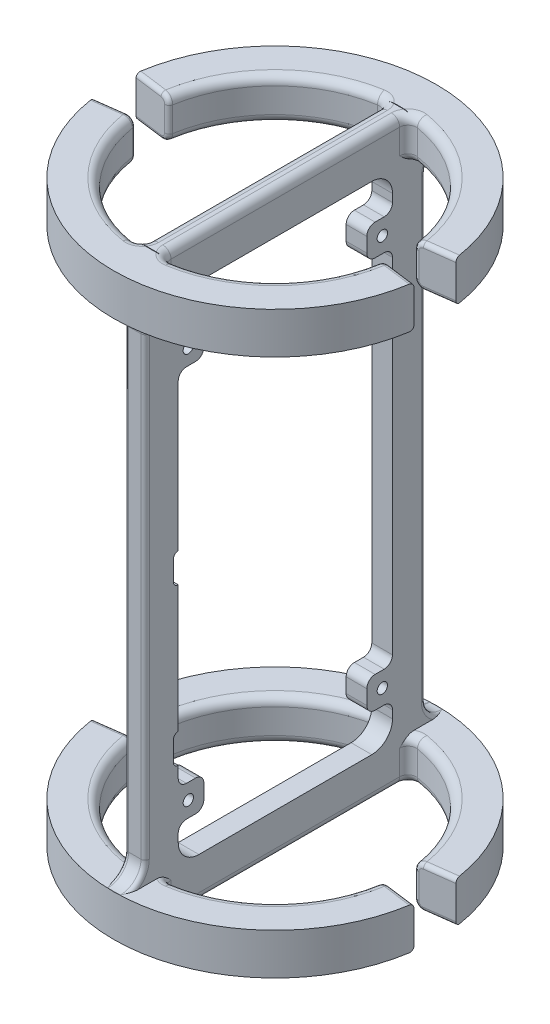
SolidWorks part; units mm, degrees
ref_plane "Front Plane" through (0, 0, 0) normal (0, 0, 1) x (1, 0, 0)
ref_plane "Top Plane" through (0, 0, 0) normal (0, 1, 0) x (1, 0, 0)
ref_plane "Right Plane" through (0, 0, 0) normal (1, 0, 0) x (0, 0, -1)
sketch "Sketch1" plane through (0, 0, 0) normal (0, 1, 0) x (1, 0, 0)
  line L0 (-3.175, -37.9675) -> (-3.175, 37.9675)
  line L3 (3.175, -37.9675) -> (3.175, 37.9675)
  line L4 (-3.164, -37.9684) -> (3.175, 38.1) construction
  line L5 (-3.164, 37.9684) -> (3.164, -37.9684) construction
  circle A0 centre (0, 0) radius 49.53
  circle A1 centre (0, 0) radius 38.1
  dimension "D1" = 99.06
  dimension "D2" = 76.2
  dimension "D3" = 6.35
extrude "Boss-Extrude1" add sketch "Sketch1" along normal blind 12.7 contours A0 A1 | L3 A1 L0
sketch "Sketch4" plane through (0, 12.7, 0) normal (0, 1, 0) x (1, 0, 0)
  line L4 (-3.175, -43.05) -> (-3.175, 43.05)
  line L5 (-3.175, -43.05) -> (3.175, -43.05)
  line L6 (-3.175, 43.05) -> (3.175, 43.05)
  line L7 (3.175, -43.05) -> (3.175, 43.05)
  line L8 (-3.175, -43.05) -> (3.175, 43.05) construction
  line L9 (-3.175, 43.05) -> (3.175, -43.05) construction
  line L11 (3.175, -32.89) -> (-3.175, -32.89)
  line L12 (3.175, -32.89) -> (3.175, 32.89)
  line L13 (3.175, 32.89) -> (-3.175, 32.89)
  line L14 (-3.175, -32.89) -> (-3.175, 32.89)
  point P1 (0, 0)
  dimension "D1" = 86.1
  dimension "D2" = 6.35
  dimension "D3" = 10.16
  dimension "D4" = 10.16
extrude "Boss-Extrude4" add sketch "Sketch4" along normal blind 152.4 contours L11 L4 L5 M8 | L13 L6 M8 M10
sketch "Sketch6" plane through (0, 165.1, 0) normal (0, 1, 0) x (1, 0, 0)
  line L0 (-3.175, -32.89) -> (-3.175, -43.05) construction
  line L2 (-3.175, -37.97) -> (3.175, -37.97)
  line L3 (-3.175, -37.97) -> (-3.175, 37.97)
  line L5 (-3.175, 37.97) -> (3.175, 37.97)
  line L6 (3.175, -37.97) -> (3.175, 37.97)
  line L7 (3.175, 32.89) -> (3.175, 43.05) construction
  circle A2 centre (0, 0) radius 38.1
  circle A3 centre (0, 0) radius 49.53
  dimension "D1" = 76.2
  dimension "D2" = 99.06
extrude "Boss-Extrude8" add sketch "Sketch6" along normal blind 12.7 contours A3 A2 L3 L5 L6 M3 M6 M5 | L6 A2 L5 L3 M4 | L2 A2 L6 M4 M5 | A2 L2 M5 M6 M3
sketch "Sketch7" plane through (0, 0, 0) normal (0, -1, 0) x (1, 0, 0)
  line L0 (-37.774, -4.973) -> (-49.1063, -6.465)
  line L1 (54.483, 0) -> (-54.483, 0) construction
  line L2 (-37.774, 4.973) -> (-49.1063, 6.465)
  line L3 (0, -54.483) -> (0, 54.483) construction
  line L4 (37.774, 4.973) -> (49.1063, 6.465)
  line L5 (37.774, -4.973) -> (49.1063, -6.465)
  arc A0 (-49.1063, 6.465) -> (-49.1063, -6.465) centre (0, 0) ccw
  arc A2 (-37.774, 4.973) -> (-37.774, -4.973) centre (0, 0) ccw
  arc A4 (37.774, 4.973) -> (37.774, -4.973) centre (0, 0) cw
  arc A5 (49.1063, 6.465) -> (49.1063, -6.465) centre (0, 0) cw
extrude "Cut-Extrude1" cut sketch "Sketch7" against normal through all and the other way through all contours L2 L0 M1 M9 | L5 L4 M8 M9 | L4 A4 L5 M8 | A2 L2 L0 M1
sketch "Sketch8" plane through (0, 0, -32.89) normal (0, 0, 1) x (1, 0, 0)
  line L0 (3.175, 165.1) -> (3.175, 12.7) construction
  line L1 (3.175, 24.003) -> (-3.175, 24.003)
  line L2 (3.175, 24.003) -> (3.175, 33.528)
  line L3 (3.175, 33.528) -> (-3.175, 33.528)
  line L4 (-3.175, 24.003) -> (-3.175, 33.528)
  line L5 (-3.175, 165.1) -> (-3.175, 12.7) construction
  line L6 (3.175, 12.7) -> (-3.175, 12.7) construction
  line L7 (-3.175, 144.272) -> (3.175, 144.272)
  line L8 (-3.175, 144.272) -> (-3.175, 153.797)
  line L9 (-3.175, 153.797) -> (3.175, 153.797)
  line L10 (3.175, 144.272) -> (3.175, 153.797)
  point P14 (0, 12.7)
  dimension "D1" = 11.303
  dimension "D2" = 9.525
  dimension "D3" = 9.525
  dimension "D4" = 11.303
extrude "Boss-Extrude9" add sketch "Sketch8" along normal blind 7.874
ref_plane "Plane1" through (0, 0, 0.003) normal (0, 0, 1) x (1, 0, 0)
mirror "Mirror1" about plane through (0, 0, 0.003) normal (0, 0, 1) of "Boss-Extrude9"
fillet "Fillet1" radius 6.35 8 edges at (0, 12.7, 43.05) (0, 165.1, 43.05) (0, 12.7, -43.05) (0, 165.1, -43.05) (0, 12.7, -32.89) (0, 165.1, -32.89) (0, 12.7, 32.89) (0, 165.1, 32.89)
fillet "Fillet2" radius 2.54 8 edges at (-3.175, 6.35, -37.9675) (-3.175, 6.35, 37.9675) (3.175, 171.45, -37.9675) (-3.175, 171.45, 37.9675) (-3.175, 171.45, -37.9675) (3.175, 171.45, 37.9675) (3.175, 6.35, -37.9675) (3.175, 6.35, 37.9675)
fillet "Fillet3" radius 2.54 36 edges at (-4.0696, 177.8, -37.0328) (-4.0696, 165.1, -37.0328) (-4.0696, 177.8, 37.0328) (-4.0696, 165.1, 37.0328) (4.0696, 177.8, 37.0328) (4.0696, 165.1, 37.0328) (4.0696, 177.8, -37.0328) (4.0696, 165.1, -37.0328) (-27.3487, 0, 26.5266) (-4.0696, 0, 37.0328) (-3.175, 0, 0) (-4.0696, 0, -37.0328) (27.3487, 0, 26.5266) (4.0696, 0, 37.0328) (3.175, 0, 0) (4.0696, 0, -37.0328) (-27.3487, 177.8, 26.5266) (-27.3487, 165.1, 26.5266) (-3.175, 177.8, 0) (27.3487, 165.1, 26.5266) (27.3487, 177.8, 26.5266) (3.175, 177.8, 0) (-4.0696, 12.7, 37.0328) (4.0696, 12.7, 37.0328) (-4.0696, 12.7, -37.0328) (4.0696, 12.7, -37.0328) (-27.3487, 165.1, -26.5266) (-27.3487, 177.8, -26.5266) (27.3487, 177.8, -26.5266) (27.3487, 165.1, -26.5266) (-27.3487, 0, -26.5266) (27.3487, 0, -26.5266) (-27.3487, 12.7, 26.5266) (27.3487, 12.7, 26.5266) (-27.3487, 12.7, -26.5266) (27.3487, 12.7, -26.5266)
sketch "Sketch9" plane through (3.175, 0, 0) normal (1, 0, 0) x (0, 0, -1)
  line L0 (25.016, 24.003) -> (25.016, 33.528) construction
  line L2 (25.016, 33.528) -> (32.89, 33.528) construction
  line L3 (25.016, 153.797) -> (32.89, 153.797) construction
  line L4 (25.016, 144.272) -> (25.016, 153.797) construction
  circle A0 centre (29.7785, 28.7655) radius 1.5875
  circle A1 centre (29.7785, 149.0345) radius 1.5875
  dimension "D1" = 3.175
  dimension "D4" = 3.175
  dimension "D2" = 4.7625
  dimension "D3" = 4.7625
  dimension "D5" = 4.7625
  dimension "D6" = 4.7625
extrude "Cut-Extrude2" cut sketch "Sketch9" against normal through all
mirror "Mirror2" about plane through (0, 0, 0.003) normal (0, 0, 1) of "Cut-Extrude2"
sketch "Sketch10" plane through (-3.175, 0, 0) normal (-1, 0, 0) x (0, 0, 1)
  line L0 (32.89, 144.272) -> (32.89, 33.528) construction
  line L1 (32.89, 48.598) -> (34.39, 48.598)
  line L2 (32.89, 48.598) -> (32.89, 39.598)
  line L3 (32.89, 39.598) -> (34.39, 39.598)
  line L4 (34.39, 48.598) -> (34.39, 39.598)
  line L6 (32.89, 96.598) -> (34.39, 96.598)
  line L7 (32.89, 96.598) -> (32.89, 87.598)
  line L8 (32.89, 87.598) -> (34.39, 87.598)
  line L9 (34.39, 96.598) -> (34.39, 87.598)
  point P10 (0, 0)
  point P12 (0, 0)
  dimension "D1" = 1.5
  dimension "D2" = 9
  dimension "D3" = 6.07
  dimension "D4" = 1.5
  dimension "D5" = 9
  dimension "D6" = 48
extrude "Cut-Extrude3" cut sketch "Sketch10" against normal through all
fillet "Fillet4" radius 2.54 16 edges at (0, 24.003, 32.89) (0, 144.272, 25.022) (0, 144.272, 32.89) (0, 24.003, 25.022) (0, 33.528, 25.022) (0, 33.528, 32.89) (0, 153.797, 25.022) (0, 153.797, 32.89) (0, 153.797, -32.89) (0, 153.797, -25.016) (0, 144.272, -25.016) (0, 144.272, -32.89) (0, 24.003, -32.89) (0, 24.003, -25.016) (0, 33.528, -25.016) (0, 33.528, -32.89)
fillet "Fillet5" radius 1.27 12 edges at (-3.175, 163.2401, -44.9099) (-3.175, 14.5599, -44.9099) (3.175, 163.2401, -44.9099) (3.175, 14.5599, -44.9099) (-3.175, 163.2401, 44.9099) (-3.175, 14.5599, 44.9099) (3.175, 163.2401, 44.9099) (3.175, 14.5599, 44.9099) (-3.175, 88.9, -43.05) (3.175, 88.9, -43.05) (-3.175, 88.9, 43.05) (3.175, 88.9, 43.05)
fillet "Fillet6" radius 1.27 40 edges at (-44.6993, 0, -5.8848) (-38.5116, 0.7439, -5.0702) (-37.774, 6.35, -4.973) (-38.5116, 11.9561, -5.0702) (-44.6993, 0, 5.8848) (-38.5116, 0.7439, 5.0702) (-37.774, 6.35, 4.973) (-38.5116, 11.9561, 5.0702) (44.6993, 0, 5.8848) (38.5116, 0.7439, 5.0702) (37.774, 6.35, 4.973) (38.5116, 11.9561, 5.0702) (44.6993, 0, -5.8848) (38.5116, 0.7439, -5.0702) (37.774, 6.35, -4.973) (38.5116, 11.9561, -5.0702) (-44.6993, 165.1, 5.8848) (-38.5116, 165.8439, 5.0702) (-37.774, 171.45, 4.973) (-38.5116, 177.0561, 5.0702) (44.6993, 165.1, 5.8848) (38.5116, 165.8439, 5.0702) (37.774, 171.45, 4.973) (38.5116, 177.0561, 5.0702) (-44.6993, 165.1, -5.8848) (-38.5116, 165.8439, -5.0702) (-37.774, 171.45, -4.973) (-38.5116, 177.0561, -5.0702) (44.6993, 165.1, -5.8848) (38.5116, 165.8439, -5.0702) (37.774, 171.45, -4.973) (38.5116, 177.0561, -5.0702) (-44.6993, 12.7, -5.8848) (-44.6993, 12.7, 5.8848) (44.6993, 12.7, 5.8848) (44.6993, 12.7, -5.8848) (-44.6993, 177.8, 5.8848) (44.6993, 177.8, 5.8848) (-44.6993, 177.8, -5.8848) (44.6993, 177.8, -5.8848)
fillet "Fillet7" radius 1.5 4 edges at (0, 48.598, 34.39) (0, 39.598, 34.39) (0, 87.598, 34.39) (0, 96.598, 34.39)
